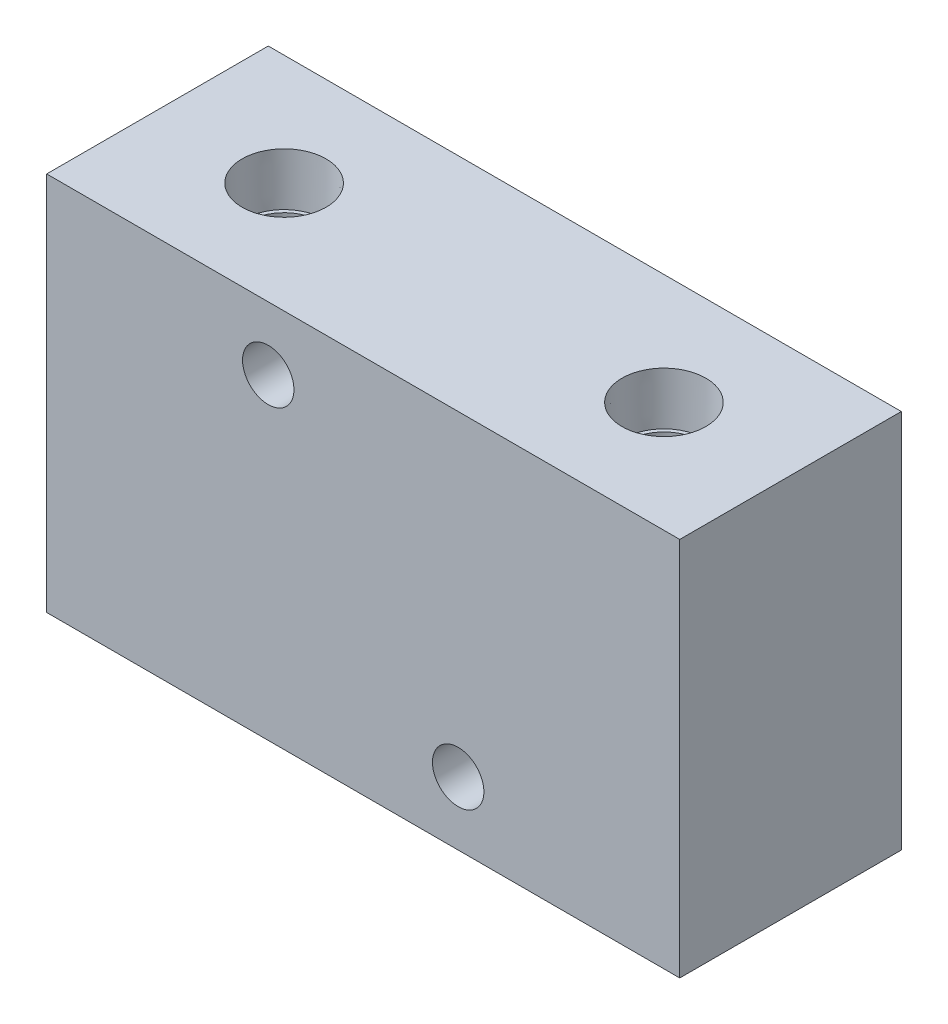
SolidWorks part; units mm, degrees
ref_plane "Front" through (0, 0, 0) normal (0, 0, 1) x (1, 0, 0)
ref_plane "Top" through (0, 0, 0) normal (0, 1, 0) x (1, 0, 0)
ref_plane "Right" through (0, 0, 0) normal (1, 0, 0) x (0, 0, -1)
sketch "Sketch1" plane through (0, 0, 0) normal (0, 0, 1) x (1, 0, 0)
  line L0 (-63.5, -38.1) -> (63.5, -38.1)
  line L1 (-63.5, -38.1) -> (-63.5, 38.1)
  line L2 (63.5, 38.1) -> (-63.5, 38.1)
  line L3 (63.5, 38.1) -> (63.5, -38.1)
  line L4 (-63.5, 38.1) -> (63.5, -38.1) construction
  dimension "D1" = 127
  dimension "D2" = 76.2
extrude "Base-Extrude" add sketch "Sketch1" along normal blind 44.45
sketch "Sketch6" plane through (0, 38.1, 0) normal (0, 1, 0) x (-1, 0, 0)
  line L0 (-63.5, 22.225) -> (63.5, 22.225) construction
  line L1 (-63.5, 44.45) -> (-63.5, 0) construction
  line L2 (63.5, 44.45) -> (63.5, 0) construction
  line L3 (-38.1, 0) -> (-38.1, 22.225) construction
  line L4 (-63.5, 0) -> (63.5, 0) construction
  line L5 (0, 0) -> (0, 22.225) construction
  line L6 (38.1, 0) -> (38.1, 22.225) construction
  dimension "D1" = 38.1
  dimension "D2" = 38.1
sketch "Sketch7" plane through (140.203, -38.1, 6.5132) normal (0, -1, 0) x (1, 0, 0)
  line L0 (-203.703, 15.7118) -> (-76.703, 15.7118) construction
  line L3 (-178.303, -6.5132) -> (-178.303, 15.7118) construction
  line L5 (-140.203, -6.5132) -> (-140.203, 15.7118) construction
  line L6 (-102.103, -6.5132) -> (-102.103, 15.7118) construction
  line L7 (-76.703, 37.9368) -> (-76.703, -6.5132) construction
  line L8 (-203.703, -6.5132) -> (-76.703, -6.5132) construction
sketch "Sketch8" plane through (0, 0, 0) normal (0, 0, -1) x (-1, 0, 0)
  line L0 (0, -38.1) -> (0, 38.1) construction
  point P4 (0, 0)
sketch "Sketch13" plane through (-63.5, 42.3823, -29.0742) normal (-1, 0, 0) x (0, 0, 1)
  line L0 (29.0742, -4.2823) -> (73.2734, -80.4823) construction
  line L1 (73.5242, -80.4823) -> (29.0742, -80.4823) construction
  circle A0 centre (51.1738, -42.3823) radius 10.4724
  dimension "Pipe OD" = 20.9448
extrude "Cut-Extrude7" cut sketch "Sketch13" against normal blind 13.5712 draft 1.783
sketch "Sketch14" plane through (-63.5, 38.1, -63.5) normal (-1, 0, 0) x (0, 0, 1)
  circle A0 centre (85.5996, -38.1) radius 8.9281
  dimension "D1" = 17.8562
extrude "Cut-Extrude8" cut sketch "Sketch14" against normal blind 114.3
sketch "Sketch15" plane through (50.8, 38.1, -63.5) normal (-1, 0, 0) x (0, 0, 1)
  arc A1 (94.5277, -38.1) -> (94.5277, -38.1) centre (85.5996, -38.1) ccw
  circle A2 centre (85.5996, -38.1) radius 8.9281
  dimension "D1" = 0
extrude "Cut-Extrude9" cut sketch "Sketch15" against normal up to next (12.7 mm away) draft 60
sketch "Sketch16" plane through (-49.9288, 38.1, -63.5) normal (-1, 0, 0) x (0, 0, 1)
  circle A0 centre (85.5996, -38.1) radius 10.0499 construction
  circle A1 centre (85.5996, -38.1) radius 10.0499
other ".50 NPT1"
sketch "Sketch17" plane through (97.8636, -38.1, 25.9971) normal (0, -1, 0) x (1, 0, 0)
  circle A0 centre (-59.7636, -3.7721) radius 8.4188
  dimension "Pipe OD" = 16.8377
extrude "Cut-Extrude10" cut sketch "Sketch17" against normal blind 10.3302 draft 1.783
sketch "Sketch18" plane through (98.7025, -38.1, 22.225) normal (0, -1, 0) x (1, 0, 0)
  circle A0 centre (-60.6025, 0) radius 7.3406
  dimension "D1" = 14.6812
extrude "Cut-Extrude11" cut sketch "Sketch18" against normal up to surface (38.1 mm away)
sketch "Sketch19" [suppressed] plane through (98.7025, -12.7, 22.225) normal (0, -1, 0) x (1, 0, 0)
  circle A1 centre (-60.6025, 0) radius 7.3406
  circle A2 centre (-60.6025, 0) radius 7.3406
  dimension "D1" = 0
extrude "Cut-Extrude12" [suppressed] cut sketch "Sketch19" against normal up to next draft 60
sketch "Sketch20" plane through (98.7025, -27.7698, 22.225) normal (0, -1, 0) x (1, 0, 0)
  circle A1 centre (-60.6025, 0) radius 8.0972
  circle A2 centre (-60.6025, 0) radius 8.0972
  dimension "D1" = 0
other ".38 NPT2" [suppressed]
sketch "Sketch21" plane through (60.496, -38.1, 35.4376) normal (0, -1, 0) x (1, 0, 0)
  circle A0 centre (-60.496, -13.2126) radius 8.4188
  dimension "Pipe OD" = 16.8377
extrude "Cut-Extrude13" cut sketch "Sketch21" against normal blind 10.3302 draft 1.783
sketch "Sketch22" plane through (61.3349, -38.1, 31.6655) normal (0, -1, 0) x (1, 0, 0)
  circle A0 centre (-61.3349, -9.4405) radius 7.3406
  dimension "D1" = 14.6812
extrude "Cut-Extrude14" cut sketch "Sketch22" against normal up to surface (38.1 mm away)
sketch "Sketch23" [suppressed] plane through (61.3349, -12.7, 31.6655) normal (0, -1, 0) x (1, 0, 0)
  circle A1 centre (-61.3349, -9.4405) radius 7.3406
  circle A2 centre (-61.3349, -9.4405) radius 7.3406
  dimension "D1" = 0
extrude "Cut-Extrude15" [suppressed] cut sketch "Sketch23" against normal up to next draft 60
sketch "Sketch24" plane through (61.3349, -27.7698, 31.6655) normal (0, -1, 0) x (1, 0, 0)
  circle A1 centre (-61.3349, -9.4405) radius 8.0972
  circle A2 centre (-61.3349, -9.4405) radius 8.0972
  dimension "D1" = 0
other "LibFeat5" [suppressed]
sketch "Sketch25" plane through (25.3074, -38.1, 36.2367) normal (0, -1, 0) x (1, 0, 0)
  circle A0 centre (-63.4074, -14.0117) radius 8.4188
  dimension "Pipe OD" = 16.8377
extrude "Cut-Extrude16" cut sketch "Sketch25" against normal blind 10.3378 draft 1.783
sketch "Sketch26" plane through (26.1463, -38.1, 32.4646) normal (0, -1, 0) x (1, 0, 0)
  circle A0 centre (-64.2463, -10.2396) radius 7.3406
  dimension "D1" = 14.6812
extrude "Cut-Extrude17" cut sketch "Sketch26" against normal up to next
sketch "Sketch27" [suppressed] plane through (26.1463, -12.7, 32.4646) normal (0, -1, 0) x (1, 0, 0)
  circle A1 centre (-64.2463, -10.2396) radius 7.3406
  circle A2 centre (-64.2463, -10.2396) radius 7.3406
  dimension "D1" = 0
extrude "Cut-Extrude18" [suppressed] cut sketch "Sketch27" against normal up to next draft 60
sketch "Sketch28" plane through (26.1463, -27.7622, 32.4646) normal (0, -1, 0) x (1, 0, 0)
  circle A1 centre (-64.2463, -10.2396) radius 8.097
  circle A2 centre (-64.2463, -10.2396) radius 8.097
  dimension "D1" = 0
other "LibFeat6" [suppressed]
mirror "Mirror1" about plane through (0, 0, 0) normal (0, 1, 0) of "Cut-Extrude10", "Cut-Extrude11", "Cut-Extrude16", "Cut-Extrude17"
sketch "Sketch29" plane through (0, 0, 0) normal (0, 0, -1) x (-1, 0, 0)
  line L0 (50, 0) -> (-50, 0) construction
  line L1 (0, -38.1) -> (0, 38.1) construction
  circle A0 centre (-19.05, -25.4) radius 5.1562
  circle A1 centre (19.05, 25.4) radius 5.1562
  dimension "D1" = 10.3124
  dimension "D2" = 25.4
  dimension "D5" = 19.05
  dimension "D3" = 25.4
  dimension "D4" = 19.05
extrude "Cut-Extrude19" cut sketch "Sketch29" against normal through all
